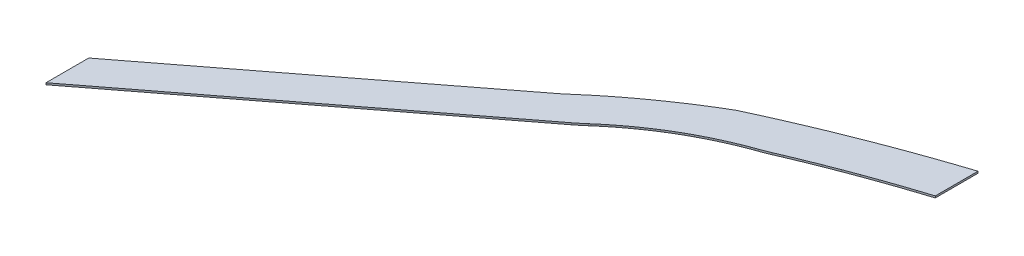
SolidWorks part; units mm, degrees
ref_plane "Plan de face" through (0, 0, 0) normal (0, 0, 1) x (1, 0, 0)
ref_plane "Plan de dessus" through (0, 0, 0) normal (0, 1, 0) x (1, 0, 0)
ref_plane "Plan de droite" through (0, 0, 0) normal (1, 0, 0) x (0, 0, -1)
ref_plane "Plan1" through (0.0012, 2.0741, 0.0016) normal (-0.0006, -1, -0.0008) x (-1, 0.0006, 0)
sketch "Esquisse22" plane through (0.0012, 2.0741, 0.0016) normal (-0.0006, -1, -0.0008) x (-1, 0.0006, 0)
  line L5 (-714.9928, -2167.2183) -> (-10.0038, -2707.8971)
  line L6 (-1494.0854, -1568.2293) -> (-714.9928, -2167.2183)
  line L7 (-1450.0018, -1840.6294) -> (-1690.0011, -1656.5593)
  line L8 (-730.0018, -2392.8101) -> (-1450.0018, -1840.6294)
  line L9 (-9.9997, -2945.001) -> (-730.0018, -2392.8101)
  line L85 (-1690.0011, -1656.5593) -> (-1704.673, -1643.3932)
  line L86 (-1704.673, -1643.3932) -> (-1719.4855, -1630.3853)
  line L87 (-1719.4855, -1630.3853) -> (-1734.4367, -1617.5373)
  line L88 (-1734.4367, -1617.5373) -> (-1749.5251, -1604.8507)
  line L89 (-1749.5251, -1604.8507) -> (-1764.7491, -1592.3269)
  line L90 (-1764.7491, -1592.3269) -> (-1780.1066, -1579.9673)
  line L91 (-1780.1066, -1579.9673) -> (-1795.5959, -1567.7735)
  line L92 (-1795.5959, -1567.7735) -> (-1811.2155, -1555.7467)
  line L93 (-1811.2155, -1555.7467) -> (-1826.9633, -1543.8884)
  line L94 (-1826.9633, -1543.8884) -> (-1842.8375, -1532.1999)
  line L95 (-1842.8375, -1532.1999) -> (-1858.8364, -1520.6826)
  line L96 (-1858.8364, -1520.6826) -> (-1874.9581, -1509.3378)
  line L97 (-1874.9581, -1509.3378) -> (-1891.2007, -1498.167)
  line L98 (-1891.2007, -1498.167) -> (-1907.5623, -1487.1711)
  line L99 (-1907.5623, -1487.1711) -> (-1924.0412, -1476.3518)
  line L100 (-1924.0412, -1476.3518) -> (-1940.6354, -1465.71)
  line L101 (-1940.6354, -1465.71) -> (-1957.3428, -1455.2471)
  line L102 (-1957.3428, -1455.2471) -> (-1974.1617, -1444.9642)
  line L103 (-1974.1617, -1444.9642) -> (-1991.0901, -1434.8627)
  line L104 (-1991.0901, -1434.8627) -> (-2008.126, -1424.9435)
  line L105 (-2008.126, -1424.9435) -> (-2025.2676, -1415.2079)
  line L106 (-2025.2676, -1415.2079) -> (-2042.5126, -1405.657)
  line L107 (-2042.5126, -1405.657) -> (-2059.8593, -1396.2919)
  line L108 (-2059.8593, -1396.2919) -> (-2077.3055, -1387.1138)
  line L109 (-2077.3055, -1387.1138) -> (-2094.8493, -1378.1235)
  line L110 (-2094.8493, -1378.1235) -> (-2112.4887, -1369.3221)
  line L111 (-2112.4887, -1369.3221) -> (-2130.2218, -1360.7108)
  line L112 (-2130.2218, -1360.7108) -> (-2148.0462, -1352.2905)
  line L113 (-2148.0462, -1352.2905) -> (-2165.9601, -1344.0622)
  line L114 (-2165.9601, -1344.0622) -> (-2183.9611, -1336.0266)
  line L115 (-2183.9611, -1336.0266) -> (-2202.0478, -1328.1851)
  line L116 (-2202.0478, -1328.1851) -> (-2220.2174, -1320.5381)
  line L117 (-2220.2174, -1320.5381) -> (-2238.4682, -1313.0867)
  line L118 (-2238.4682, -1313.0867) -> (-2256.798, -1305.832)
  line L119 (-2256.798, -1305.832) -> (-2275.2044, -1298.7745)
  line L120 (-2275.2044, -1298.7745) -> (-2293.6859, -1291.915)
  line L121 (-2293.6859, -1291.915) -> (-2312.2399, -1285.2546)
  line L122 (-2312.2399, -1285.2546) -> (-2330.863, -1278.7939)
  line L123 (-2330.863, -1278.7939) -> (-2406.2881, -1246.6004)
  line L124 (-2406.2881, -1246.6004) -> (-2482.0788, -1215.2771)
  line L125 (-2482.0788, -1215.2771) -> (-2558.2249, -1184.8282)
  line L126 (-2558.2249, -1184.8282) -> (-2634.7165, -1155.2578)
  line L127 (-2634.7165, -1155.2578) -> (-2711.5433, -1126.5699)
  line L128 (-2711.5433, -1126.5699) -> (-2788.6953, -1098.7682)
  line L129 (-2788.6953, -1098.7682) -> (-2866.1623, -1071.8563)
  line L130 (-2866.1623, -1071.8563) -> (-2943.9337, -1045.8379)
  line L131 (-2943.9337, -1045.8379) -> (-3021.9996, -1020.7165)
  line L132 (-3021.9996, -1020.7165) -> (-3022.0011, -783.6178)
  line L133 (-3022.0011, -783.6178) -> (-2932.5653, -813.13)
  line L134 (-2932.5653, -813.13) -> (-2843.4628, -843.6341)
  line L135 (-2843.4628, -843.6341) -> (-2754.7048, -875.1262)
  line L136 (-2754.7048, -875.1262) -> (-2666.3023, -907.6026)
  line L137 (-2666.3023, -907.6026) -> (-2578.266, -941.0592)
  line L138 (-2578.266, -941.0592) -> (-2490.6069, -975.4919)
  line L139 (-2490.6069, -975.4919) -> (-2403.3357, -1010.8964)
  line L140 (-2403.3357, -1010.8964) -> (-2316.4631, -1047.2683)
  line L141 (-2316.4631, -1047.2683) -> (-2230.0001, -1084.6032)
  line L142 (-2230.0001, -1084.6032) -> (-2143.9575, -1122.8965)
  line L143 (-2143.9575, -1122.8965) -> (-2058.3447, -1162.1442)
  line L144 (-2058.3447, -1162.1442) -> (-2025.004, -1181.7596)
  line L145 (-2025.004, -1181.7596) -> (-1991.8776, -1201.7349)
  line L146 (-1991.8776, -1201.7349) -> (-1958.9693, -1222.0676)
  line L147 (-1958.9693, -1222.0676) -> (-1926.2831, -1242.7553)
  line L148 (-1926.2831, -1242.7553) -> (-1893.8226, -1263.7955)
  line L149 (-1893.8226, -1263.7955) -> (-1861.5919, -1285.1859)
  line L150 (-1861.5919, -1285.1859) -> (-1829.5945, -1306.924)
  line L151 (-1829.5945, -1306.924) -> (-1797.8344, -1329.0071)
  line L152 (-1797.8344, -1329.0071) -> (-1766.3151, -1351.4328)
  line L153 (-1766.3151, -1351.4328) -> (-1735.0405, -1374.1982)
  line L154 (-1735.0405, -1374.1982) -> (-1704.0141, -1397.3009)
  line L155 (-1704.0141, -1397.3009) -> (-1673.2395, -1420.738)
  line L156 (-1673.2395, -1420.738) -> (-1642.7205, -1444.5069)
  line L157 (-1642.7205, -1444.5069) -> (-1612.4605, -1468.6049)
  line L158 (-1612.4605, -1468.6049) -> (-1582.4633, -1493.0288)
  line L159 (-1582.4633, -1493.0288) -> (-1494.0854, -1568.2293)
  line L160 (-10.0038, -2707.8971) -> (-9.9997, -2945.001)
extrude "Boss.-Extru.1" add sketch "Esquisse22" along normal blind 10
fillet "Congé1" radius 1000 2 edges at (1689.9991, -5.18, 1656.5559) (2330.8609, -5.2668, 1278.7903)
